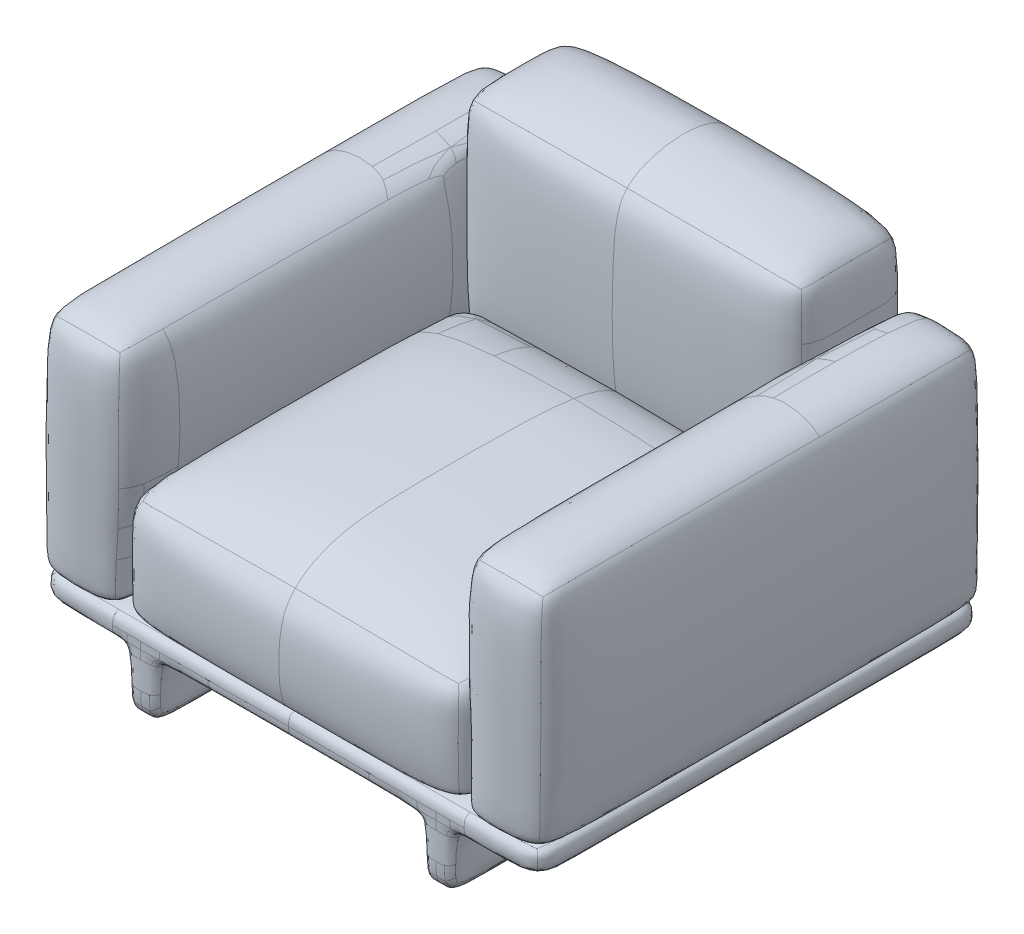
SolidWorks part; units mm, degrees
ref_plane "Plan de face" through (0, 0, 0) normal (0, 0, 1) x (1, 0, 0)
ref_plane "Plan de dessus" through (0, 0, 0) normal (0, 1, 0) x (1, 0, 0)
ref_plane "Plan de droite" through (0, 0, 0) normal (1, 0, 0) x (0, 0, -1)
other "Cube de visualisation"
ref_plane "Default Plane" through (-539.211, 357, -73.6082) normal (0, 0, 1) x (1, 0, 0)
imported_body "Directionnelle3"
move or copy body "Corps-Déplacer/Copier1" bodies to move or copy 129 128 127 126 125 124 122 121 120 119 118 117 116 123 115 114 113 112 111 110 109 108 107 106 105 104 103 copy no rotation origin (0, -17.2001, 376.25) rotation axis (-1, 0, 0) rotation angle 90
delete or keep bodies "Corps-Supprimer/Garder 1" type delete bodies bodies 156 133 134 131 132 151 137 136 150 135 147 148 130 152 145 154 153 144 149 155 146 143
delete or keep bodies "Corps-Supprimer/Garder 2" type delete bodies bodies 140
sketch "Esquisse1" plane through (0, 0, 0) normal (0, 1, 0) x (1, 0, 0)
  line L1 (-25, 100.6232) -> (25, 100.6232)
  line L2 (-25, 100.6232) -> (-25, -897.147)
  line L3 (-25, -897.147) -> (25, -897.147)
  line L4 (25, 100.6232) -> (25, -897.147)
  line L5 (0, 0) -> (0, 100.6232) construction
  dimension "D1" = 50
extrude "Enlèv. mat.-Extru.1" cut sketch "Esquisse1" against normal through all both and the other way through all
mirror "Symétrie2" about plane through (-25, -393.4511, -100.6232) normal (-1, 0, 0)
mirror "Symétrie1" about plane through (-25, -393.4511, -100.6232) normal (-1, 0, 0)
